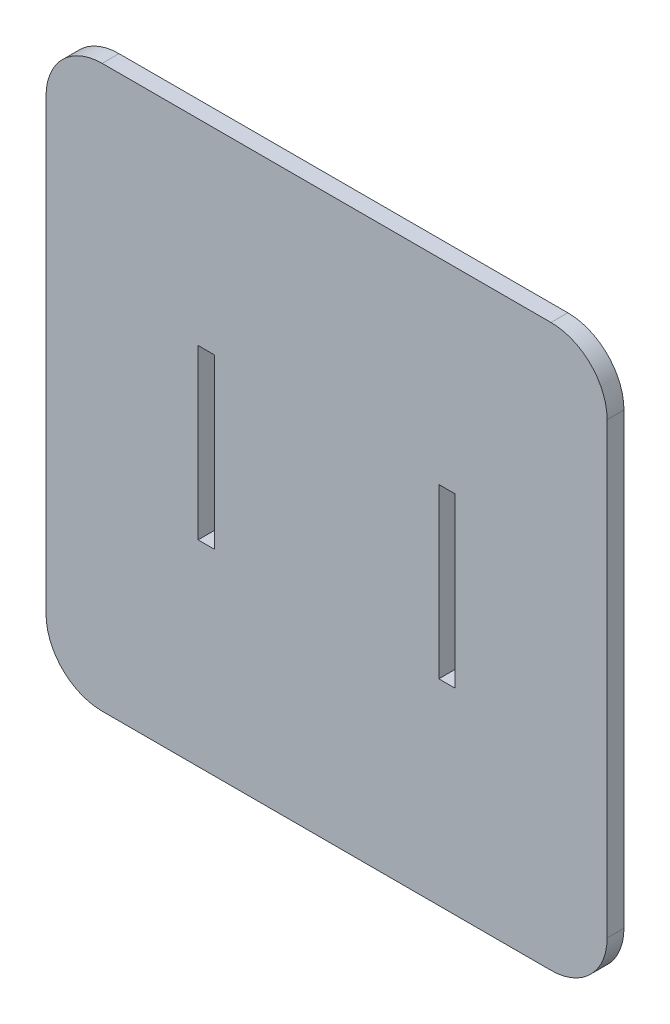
SolidWorks part; units mm, degrees
ref_plane "Plan de face" through (0, 0, 0) normal (0, 0, 1) x (1, 0, 0)
ref_plane "Plan de dessus" through (0, 0, 0) normal (0, 1, 0) x (1, 0, 0)
ref_plane "Plan de droite" through (0, 0, 0) normal (1, 0, 0) x (0, 0, -1)
sketch "Esquisse1" plane through (0, 0, 0) normal (0, 0, 1) x (1, 0, 0)
  line L0 (0, 0) -> (0, -48.741) construction
  line L1 (-40, 50) -> (40, 50)
  line L2 (-50, 40) -> (-50, -40)
  line L3 (-40, -50) -> (40, -50)
  line L4 (50, 40) -> (50, -40)
  line L5 (-50, 50) -> (50, -50) construction
  line L6 (-50, -50) -> (50, 50) construction
  line L7 (-22.9, 15) -> (-20, 15)
  line L8 (-22.9, 15) -> (-22.9, -15)
  line L9 (-22.9, -15) -> (-20, -15)
  line L10 (-20, 15) -> (-20, -15)
  line L11 (-22.9, 15) -> (-20, -15) construction
  line L12 (-22.9, -15) -> (-20, 15) construction
  line L13 (22.9, -15) -> (20, -15)
  line L14 (20, 15) -> (20, -15)
  line L15 (22.9, 15) -> (22.9, -15)
  line L16 (22.9, 15) -> (20, 15)
  arc A0 (-50, -40) -> (-40, -50) centre (-40, -40) ccw
  arc A1 (40, -50) -> (50, -40) centre (40, -40) ccw
  arc A2 (50, 40) -> (40, 50) centre (40, 40) ccw
  arc A3 (-40, 50) -> (-50, 40) centre (-40, 40) ccw
  point P0 (0, 0)
  point P6 (-21.45, 0)
  point P29 (-50.25, -33.55)
  dimension "D7" = 10
  dimension "D1" = 100
  dimension "D2" = 100
  dimension "D3" = 2.9
  dimension "D4" = 0
  dimension "D5" = 30
  dimension "D6" = 20
extrude "Boss.-Extru.1" add sketch "Esquisse1" along normal blind 3
